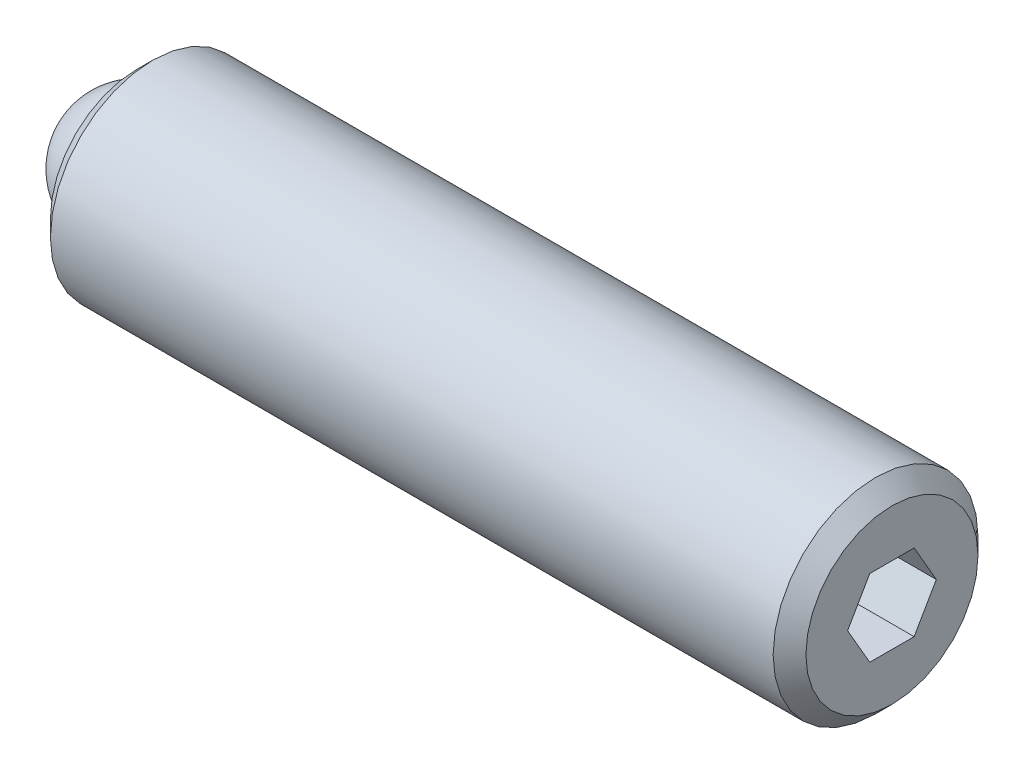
SolidWorks part; units mm, degrees
ref_plane "Front Plane" through (0, 0, 0) normal (0, 0, 1) x (1, 0, 0)
ref_plane "Top Plane" through (0, 0, 0) normal (0, 1, 0) x (1, 0, 0)
ref_plane "Right Plane" through (0, 0, 0) normal (1, 0, 0) x (0, 0, -1)
sketch "Sketch2" plane through (0, 0, 0) normal (1, 0, 0) x (0, 0, -1)
  circle A0 centre (0, 0) radius 3.175
  dimension "D1" = 6.35
extrude "Boss-Extrude1" add sketch "Sketch2" along normal blind 23.4156
sketch "Sketch3" plane through (0, 0, 0) normal (-1, 0, 0) x (0, 0, 1)
  circle A0 centre (0, 0) radius 1.9812
  dimension "D1" = 3.9624
chamfer "Chamfer1" distance 0.508 angle 45 1 edges at (0, 0, -3.175)
chamfer "Chamfer2" distance 0.508 angle 45 1 edges at (23.4156, 0, -3.175)
sketch "Sketch4" plane through (23.4156, 0, 0) normal (1, 0, 0) x (0, 0, -1)
  line L1 (1.3748, 0) -> (0.6874, 1.1906)
  line L2 (0.6874, 1.1906) -> (-0.6874, 1.1906)
  line L3 (-0.6874, 1.1906) -> (-1.3748, 0)
  line L4 (-1.3748, 0) -> (-0.6874, -1.1906)
  line L5 (-0.6874, -1.1906) -> (0.6874, -1.1906)
  line L6 (0.6874, -1.1906) -> (1.3748, 0)
  circle A0 centre (0, 0) radius 1.1906 construction
  dimension "D1" = 2.3813
extrude "Cut-Extrude2" cut sketch "Sketch4" against normal blind 2.286
extrude "Cut-Extrude3" cut sketch "Sketch3" against normal blind 1.9844
sketch "Sketch5" plane through (0, 0, 0) normal (-1, 0, 0) x (0, 0, 1)
  line L0 (0, 0) -> (0, -1.9844)
  line L1 (0, 0) -> (0, 1.9844)
  arc A0 (0, 1.9844) -> (0, -1.9844) centre (0, 0) ccw
  dimension "D1" = 1.9844
revolve "Revolve1" add sketch "Sketch5" angle 360 about L1
sketch "Sketch6" plane through (0, 0, 0) normal (-1, 0, 0) x (0, 0, 1)
  line L0 (0, 0) -> (0, 1.9812) construction
  circle A0 centre (0, 0) radius 1.9812 construction
  arc A1 (0.0635, 1.9802) -> (-0.0635, 1.9802) centre (0, 0) ccw
  arc A2 (0.0635, 1.9802) -> (-0.0635, 1.9802) centre (0, 1.9812) ccw
  dimension "D1" = 0.127
extrude "Cut-Extrude4" cut sketch "Sketch6" against normal up to surface (1.9844 mm away) contours A2 A1
